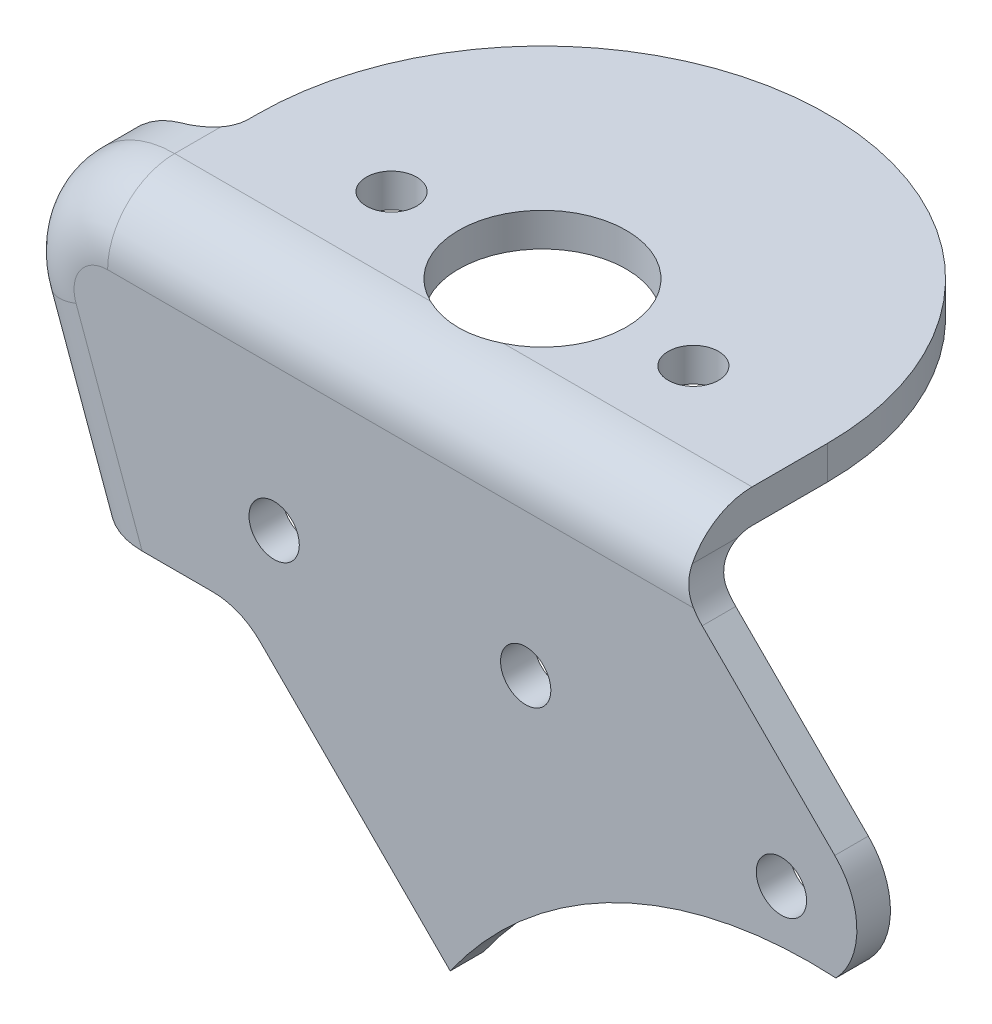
SolidWorks part; units mm, degrees
ref_plane "Plan de face" through (0, 0, 0) normal (0, 0, 1) x (1, 0, 0)
ref_plane "Plan de dessus" through (0, 0, 0) normal (0, 1, 0) x (1, 0, 0)
ref_plane "Plan de droite" through (0, 0, 0) normal (1, 0, 0) x (0, 0, -1)
sketch "Esquisse1" plane through (0, 0, 0) normal (0, 1, 0) x (1, 0, 0)
  line L0 (-18, 0) -> (18, 0) construction
  line L2 (-34, 0) -> (-34, -17)
  line L3 (-34, -17) -> (34, -17)
  line L4 (34, 0) -> (34, -17)
  circle A0 centre (-18, 0) radius 3
  circle A1 centre (0, 0) radius 10
  arc A2 (34, 0) -> (-34, 0) centre (0, 0) ccw
  circle A3 centre (18, 0) radius 3
  dimension "D1" = 34
  dimension "D2" = 20
  dimension "D4" = 6
  dimension "D5" = 6
  dimension "D3" = 17
  dimension "D6" = 36
extrude "Extrusion1" add sketch "Esquisse1" along normal blind 4
sketch "Esquisse2" plane through (0, 0, 17) normal (0, 0, 1) x (1, 0, 0)
  line L0 (34, 4) -> (34, -3.2721)
  line L1 (34, -3.2721) -> (51.864, -21.136)
  line L2 (6, -56) -> (-19, -31)
  line L3 (-19, -31) -> (-39.261, -31)
  line L4 (34, 4) -> (-52, 4)
  line L5 (-52, 4) -> (-39.261, -31)
  line L6 (-34, 0) -> (34, 0) construction
  arc A0 (52, -33.7249) -> (6, -56) centre (48.9875, -86.1384) ccw
  arc A1 (52, -33.7249) -> (51.864, -21.136) centre (45.5, -27.5) ccw
  point P4 (0, 0)
  dimension "D1" = 18
  dimension "D2" = 52.5
  dimension "D3" = 45
  dimension "D4" = 45
  dimension "D5" = 31.5
  dimension "D6" = 70
  dimension "D7" = 35
  dimension "D8" = 60
  dimension "D9" = 11.5
  dimension "D10" = 6
  dimension "D11" = 52
  dimension "D12" = 52
extrude "Extrusion2" add sketch "Esquisse2" against normal blind 4
fillet "Congé1" radius 12 1 edges at (-52, 4, 15)
sketch "Esquisse5" plane through (0, 0, 13) normal (0, 0, -1) x (-1, 0, 0)
  line L0 (46.1385, -12.1042) -> (39.261, -31) construction
  line L1 (34, 4) -> (34.8622, 4) construction
  line L2 (46.1385, -12.1042) -> (39.261, -31)
  line L3 (34, 4) -> (34.8622, 4)
  line L4 (34, 0) -> (34.8622, 0)
  line L5 (42.3798, -10.7362) -> (35.5023, -29.6319)
  line L6 (34, 0) -> (34, 4)
  line L7 (35.5023, -29.6319) -> (35.0043, -31)
  line L8 (39.261, -31) -> (19, -31) construction
  line L9 (35.0043, -31) -> (39.261, -31)
  arc A0 (46.1385, -12.1042) -> (34.8622, 4) centre (34.8622, -8) ccw construction
  arc A1 (46.1385, -12.1042) -> (34.8622, 4) centre (34.8622, -8) ccw
  arc A2 (42.3798, -10.7362) -> (34.8622, 0) centre (34.8622, -8) ccw
  dimension "D1" = 4
extrude "Extrusion4" add sketch "Esquisse5" along normal blind 8
fillet "Congé4" radius 7 1 edges at (34, -3.2721, 15)
fillet "Congé2" radius 4 4 edges at (-0.4311, 0, 13) (-41.4154, -3.4114, 13) (-38.692, -20.8681, 13) (-34, 2, 5)
fillet "Congé3" radius 8 4 edges at (-0.4311, 4, 17) (-44.692, -1.1171, 17) (-42.6998, -21.5521, 17) (-19, -31, 15)
sketch "Esquisse6" plane through (0, 0, 17) normal (0, 0, 1) x (1, 0, 0)
  line L0 (-15, -21) -> (15, -21) construction
  line L1 (0, 0) -> (0, -21) construction
  line L2 (-34.8622, 4) -> (-4.3589, 4) construction
  circle A0 centre (-15, -21) radius 3
  circle A1 centre (15, -21) radius 3
  circle A2 centre (45.5, -27.5) radius 3
  dimension "D1" = 6
  dimension "D2" = 6
  dimension "D3" = 6
  dimension "D4" = 30
  dimension "D5" = 25
extrude "Enlèv. mat.-Extru.1" cut sketch "Esquisse6" against normal through all
